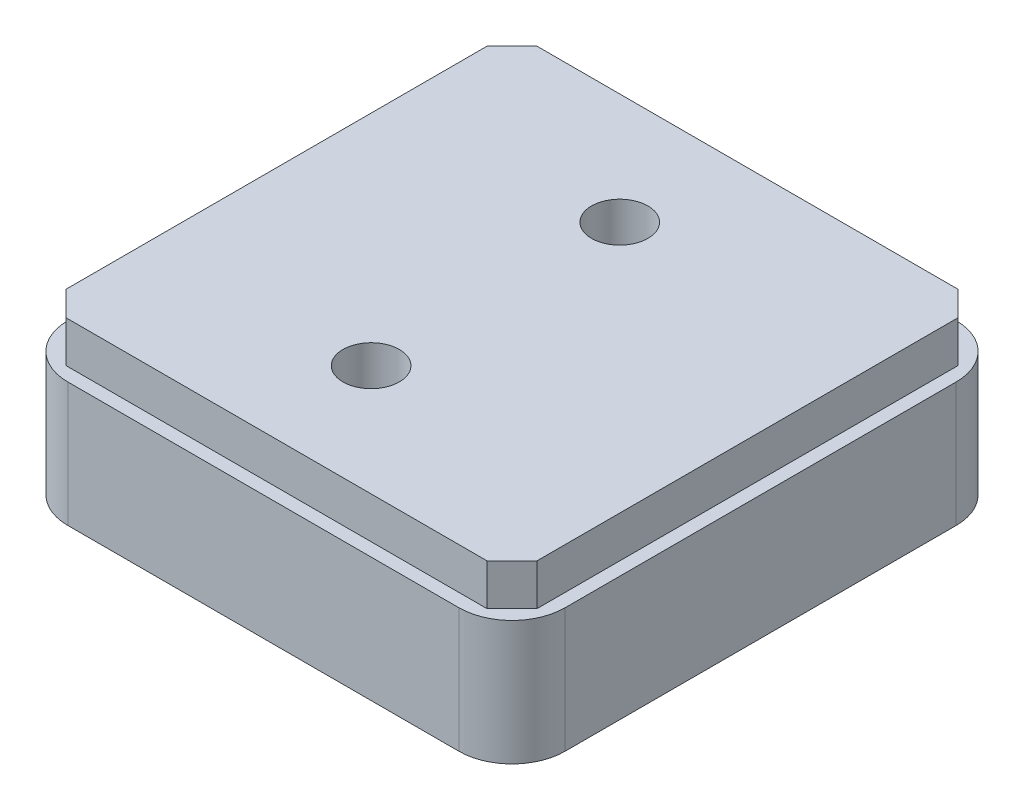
SolidWorks part; units mm, degrees
ref_plane "Plan de face" through (0, 0, 0) normal (0, 0, 1) x (1, 0, 0)
ref_plane "Plan de dessus" through (0, 0, 0) normal (0, 1, 0) x (1, 0, 0)
ref_plane "Plan de droite" through (0, 0, 0) normal (1, 0, 0) x (0, 0, -1)
sketch "Esquisse1" plane through (0, 0, 0) normal (0, 0, 1) x (1, 0, 0)
  line L0 (0, 0) -> (0, 20)
  dimension "D1" = 20
other "Elément mécano-soudé1"
ref_plane "Plan1" through (0, 0, 0) normal (0, 1, 0) x (-1, 0, 0)
sketch "Sketch1" plane through (0, 0, 0) normal (0, 1, 0) x (-1, 0, 0)
  line L0 (-23.6, -26.8) -> (23.6, -26.8)
  line L1 (-26.8, -23.6) -> (-26.8, 23.6)
  line L2 (23.6, 26.8) -> (-23.6, 26.8)
  line L3 (26.8, 23.6) -> (26.8, -23.6)
  line L4 (-23.6, -30) -> (23.6, -30)
  line L5 (-30, -23.6) -> (-30, 23.6)
  line L6 (23.6, 30) -> (-23.6, 30)
  line L7 (30, 23.6) -> (30, -23.6)
  line L8 (-30, 0) -> (-26.8, 0) construction
  line L9 (-26.8, 0) -> (26.8, 0) construction
  line L10 (26.8, 0) -> (30, 0) construction
  line L12 (0, 30) -> (0, 26.8) construction
  line L13 (0, 26.8) -> (0, -26.8) construction
  line L14 (0, -26.8) -> (0, -30) construction
  arc A0 (30, 23.6) -> (23.6, 30) centre (23.6, 23.6) ccw
  arc A1 (23.6, -30) -> (30, -23.6) centre (23.6, -23.6) ccw
  arc A2 (-30, -23.6) -> (-23.6, -30) centre (-23.6, -23.6) ccw
  arc A3 (-23.6, 30) -> (-30, 23.6) centre (-23.6, 23.6) ccw
  arc A4 (-23.6, 26.8) -> (-26.8, 23.6) centre (-23.6, 23.6) ccw
  arc A5 (26.8, 23.6) -> (23.6, 26.8) centre (23.6, 23.6) ccw
  arc A6 (23.6, -26.8) -> (26.8, -23.6) centre (23.6, -23.6) ccw
  arc A7 (-26.8, -23.6) -> (-23.6, -26.8) centre (-23.6, -23.6) ccw
  point P2 (-30, 30)
  point P33 (-30, -30)
  point P34 (30, -30)
  point P36 (30, 30)
  point P37 (0, 0)
  dimension "D1" = 6.4
  dimension "Thickness" = 3.2
  dimension "V_leg" = 60
  dimension "H_leg" = 60
other "Embout1" parameters "D1"=5, "D2"=3, "D3"=3
sketch "Esquisse3" plane through (0, 20, 0) normal (0, 1, 0) x (-1, 0, 0)
  line L0 (2, -15) -> (2, 15) construction
  line L1 (30, -23.6) -> (30, 23.6) construction
  point P0 (2, -15)
  point P1 (2, 15)
  point P4 (0, 0)
  point P7 (2, 0)
  dimension "D1" = 30
  dimension "D2" = 28
hole_wizard "Trou taraudé M81" positions "Esquisse3D1" profile "Esquisse4" tap size "M8" standard "ISO"
sketch3d "Esquisse3D1"
  point P0 (-2, 20, -15)
  point P3 (-2, 20, 15)
sketch "Esquisse4" plane through (-2, 20, -15) normal (1, 0, 0) x (0, 0, 1)
  line L0 (0, 0) -> (0, 5)
  line L1 (0, 5) -> (3.4, 5)
  line L2 (3.4, 5) -> (3.4, 0)
  line L5 (3.4, 0) -> (0, 0)
  line L11 (0, -6.35) -> (0, 107.95) construction
  dimension "Diamètre du trou pour taraudage jusqu'au prochain" = 6.8
  dimension "Profondeur du trou pour taraudage jusqu'au prochain" = 5
